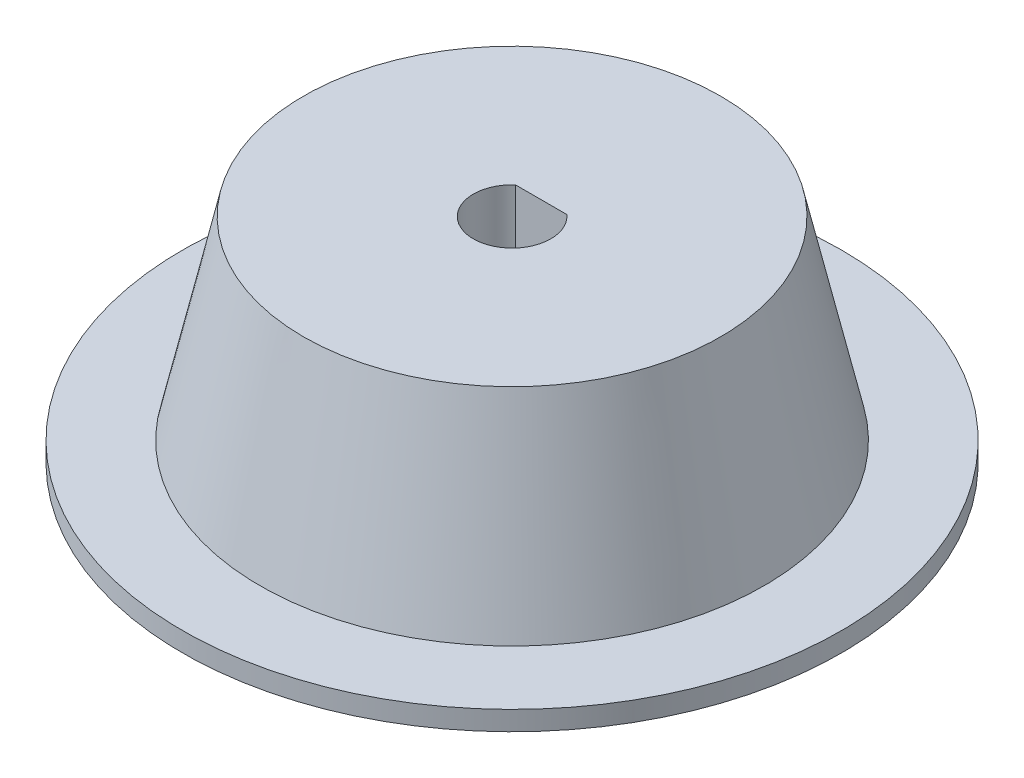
SolidWorks part; units mm, degrees
ref_plane "Front Plane" through (0, 0, 0) normal (0, 0, 1) x (1, 0, 0)
ref_plane "Top Plane" through (0, 0, 0) normal (0, 1, 0) x (1, 0, 0)
ref_plane "Right Plane" through (0, 0, 0) normal (1, 0, 0) x (0, 0, -1)
sketch "Sketch1" plane through (0, 0, 0) normal (0, 1, 0) x (1, 0, 0)
  circle A0 centre (0, 0) radius 13
  dimension "D1" = 26
extrude "Boss-Extrude1" add sketch "Sketch1" along normal blind 10
sketch "Sketch2" plane through (0, 0, 0) normal (1, 0, 0) x (0, 0, -1)
  line L0 (-13, 0) -> (-10.7574, 10)
  line L1 (13, 10) -> (-13, 10) construction
  line L2 (-10.7574, 10) -> (-13, 10)
  line L3 (-13, 10) -> (-13, 0)
  line L4 (0, 0) -> (0, 50000) construction
  line L5 (-13, 0) -> (13, 0) construction
  point P11 (0, 0)
  dimension "D1" = 12.64
revolve "Cut-Revolve1" cut sketch "Sketch2" angle 360 about L4
sketch "Sketch3" plane through (0, 0, 0) normal (0, -1, 0) x (-1, 0, 0)
  circle A0 centre (0, 0) radius 17
  dimension "D1" = 34
extrude "Boss-Extrude2" add sketch "Sketch3" along normal blind 1
sketch "Sketch4" plane through (0, -1, 0) normal (0, -1, 0) x (1, 0, 0)
  line L0 (1.145, -2.3899) -> (1.145, 2.3899)
  line L1 (-1.145, -2.3899) -> (-1.145, 2.3899)
  line L2 (0, 0) -> (35355.3391, 35355.3391) construction
  line L3 (0.8543, 0) -> (50000.8543, 0) construction
  line L4 (-2.3899, 1.145) -> (2.3899, 1.145)
  line L5 (-2.3899, -1.145) -> (2.3899, -1.145)
  circle A0 centre (0, 0) radius 2.65
  dimension "D1" = 5.3
  dimension "D2" = 2.29
  dimension "D3" = 45
extrude "Cut-Extrude1" [suppressed] cut sketch "Sketch4" against normal through all contours L1 L5 L0 L4 | L4 A0 L5 L1 | L0 A0 L1 L4 | L5 A0 L4 L0 | L1 A0 L0 L5
fillet "Fillet1" [suppressed] radius 0.5
sketch "Sketch5" plane through (0, 10, 0) normal (0, 1, 0) x (1, 0, 0)
  line L0 (-1.3229, 1.5) -> (1.3229, 1.5)
  circle A0 centre (0, 0) radius 2
  dimension "D1" = 4
  dimension "D2" = 1.5
extrude "Cut-Extrude2" cut sketch "Sketch5" against normal through all contours L0 A0
ref_plane "Plane1" through (0, 2.7758, 12.3775) normal (0, 0.2188, 0.9758) x (1, 0, 0)
sketch "Sketch7" plane through (0, 10, 0) normal (0, 1, 0) x (1, 0, 0)
  circle A0 centre (0, -9.7574) radius 1.6
  circle A1 centre (0, 0) radius 9.7574 construction
  circle A2 centre (0, 0) radius 10.7574 construction
  dimension "D1" = 3.2
  dimension "D2" = 1
sketch "Sketch8" plane through (0, 0, 0) normal (0, 1, 0) x (1, 0, 0)
  circle A0 centre (0, -12) radius 1.6
  circle A1 centre (0, 0) radius 12 construction
  circle A2 centre (0, 0) radius 13 construction
  circle A4 centre (0, -9.7574) radius 1.6 construction
  dimension "D1" = 1
loft "Cut-Loft1" [suppressed] cut profiles "Sketch7", "Sketch8"
pattern_circular "CirPattern1" [suppressed] count 15 over 360
fillet "Fillet2" [suppressed] radius 0.3
